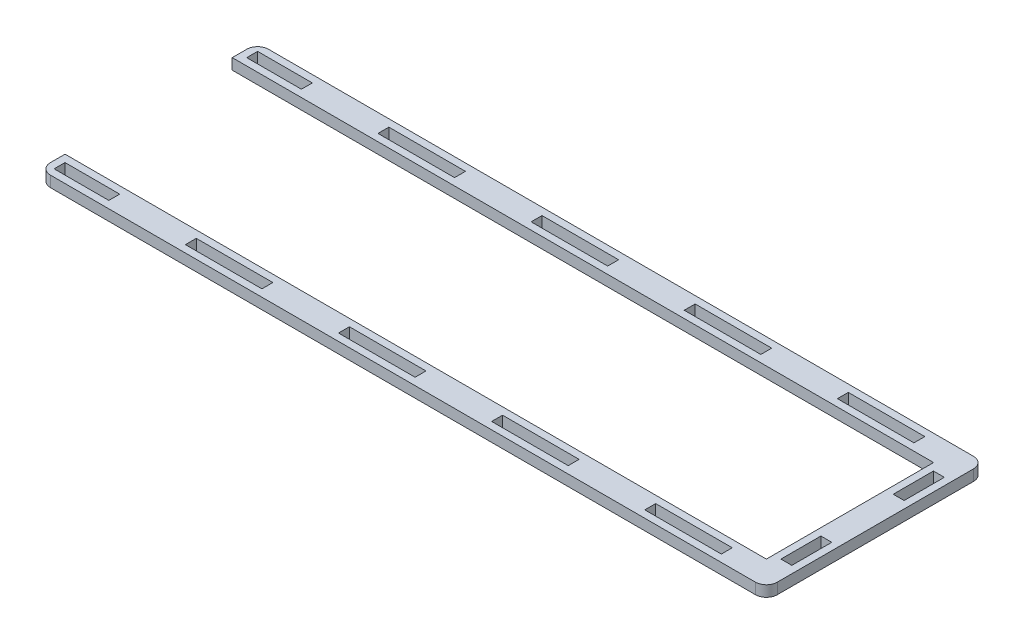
SolidWorks part; units mm, degrees
ref_plane "Front" through (0, 0, 0) normal (0, 0, 1) x (1, 0, 0)
ref_plane "Top" through (0, 0, 0) normal (0, 1, 0) x (1, 0, 0)
ref_plane "Right" through (0, 0, 0) normal (1, 0, 0) x (0, 0, -1)
sketch "Эскиз1" plane through (0, 0, 0) normal (0, 1, 0) x (1, 0, 0)
  line L0 (0, -6.9843) -> (193, -6.9843)
  line L1 (17.05, -5) -> (2, -5)
  line L2 (17.05, -5) -> (17.05, -2)
  line L3 (17.05, -2) -> (2, -2)
  line L4 (2, -5) -> (2, -2)
  line L5 (3, 0) -> (197, 0)
  line L6 (0, -3) -> (0, -6.9843)
  line L7 (3, -60) -> (197, -60)
  line L8 (200, -3) -> (200, -57)
  line L9 (38.1198, -2) -> (59.1898, -2)
  line L10 (38.1198, -2) -> (38.1198, -5)
  line L11 (38.1198, -5) -> (59.1898, -5)
  line L12 (59.1898, -2) -> (59.1898, -5)
  line L13 (80.2597, -2) -> (101.3294, -2)
  line L14 (80.2597, -2) -> (80.2597, -5)
  line L15 (80.2597, -5) -> (101.3294, -5)
  line L16 (101.3294, -2) -> (101.3294, -5)
  line L17 (122.3995, -2) -> (143.4692, -2)
  line L18 (122.3995, -2) -> (122.3995, -5)
  line L19 (122.3995, -5) -> (143.4692, -5)
  line L20 (143.4692, -2) -> (143.4692, -5)
  line L21 (164.5392, -2) -> (185.6088, -2)
  line L22 (164.5392, -2) -> (164.5392, -5)
  line L23 (164.5392, -5) -> (185.6088, -5)
  line L24 (185.6088, -2) -> (185.6088, -5)
  line L25 (195, -9.025) -> (198, -9.025)
  line L26 (195, -9.025) -> (195, -20.0897)
  line L27 (195, -20.0897) -> (198, -20.0897)
  line L28 (198, -9.025) -> (198, -20.0897)
  line L29 (195, -40) -> (198, -40)
  line L30 (195, -40) -> (195, -51)
  line L31 (195, -51) -> (198, -51)
  line L32 (198, -40) -> (198, -51)
  line L33 (185.6088, -55) -> (164.5391, -55)
  line L34 (185.6088, -55) -> (185.6088, -58)
  line L35 (185.6088, -58) -> (164.5391, -58)
  line L36 (164.5391, -55) -> (164.5391, -58)
  line L37 (143.4691, -55) -> (122.3994, -55)
  line L38 (143.4691, -55) -> (143.4691, -58)
  line L39 (143.4691, -58) -> (122.3994, -58)
  line L40 (122.3994, -55) -> (122.3994, -58)
  line L41 (101.3293, -55) -> (80.2596, -55)
  line L42 (101.3293, -55) -> (101.3293, -58)
  line L43 (101.3293, -58) -> (80.2596, -58)
  line L44 (80.2596, -55) -> (80.2596, -58)
  line L45 (59.1897, -55) -> (38.1197, -55)
  line L46 (59.1897, -55) -> (59.1897, -58)
  line L47 (59.1897, -58) -> (38.1197, -58)
  line L48 (38.1197, -55) -> (38.1197, -58)
  line L49 (17.0499, -55) -> (2, -55)
  line L50 (17.0499, -55) -> (17.0499, -58)
  line L51 (17.0499, -58) -> (2, -58)
  line L52 (2, -55) -> (2, -58)
  line L54 (193, -53) -> (193, -6.9843)
  line L55 (193, -53) -> (0, -53)
  line L56 (0, -53) -> (0, -57)
  arc A0 (197, -60) -> (200, -57) centre (197, -57) ccw
  arc A1 (197, 0) -> (200, -3) centre (197, -3) cw
  arc A2 (0, -57) -> (3, -60) centre (3, -57) ccw
  arc A3 (3, 0) -> (0, -3) centre (3, -3) ccw
  point P64 (200, -60)
  point P67 (200, 0)
  point P72 (0, 0)
  dimension "D19" = 3
  dimension "D2" = 7
  dimension "D3" = 46.0157
  dimension "D5" = 7
  dimension "D6" = 60
  dimension "D8" = 60
extrude "Бобышка-Вытянуть1" add sketch "Эскиз1" along normal blind 3
